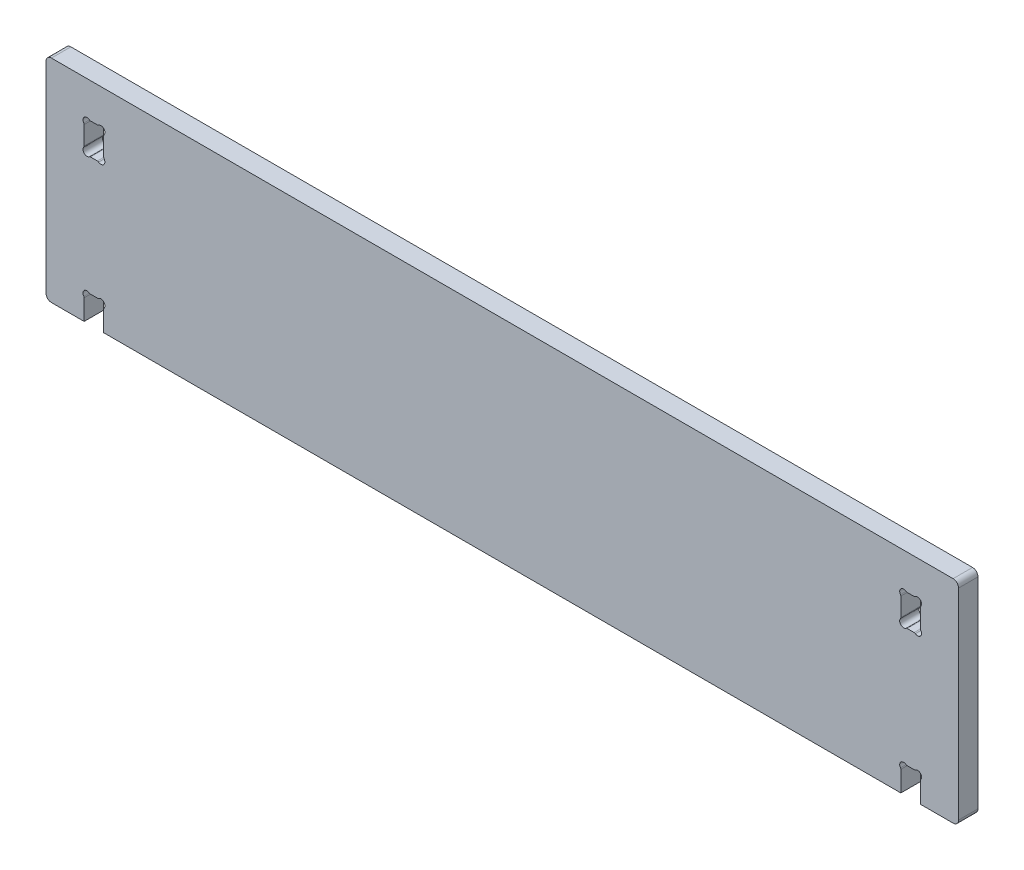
SolidWorks part; units mm, degrees
ref_plane "Front Plane" through (0, 0, 0) normal (0, 0, 1) x (1, 0, 0)
ref_plane "Top Plane" through (0, 0, 0) normal (0, 1, 0) x (1, 0, 0)
ref_plane "Right Plane" through (0, 0, 0) normal (1, 0, 0) x (0, 0, -1)
sketch "Sketch1" plane through (0, 0, 0) normal (0, 0, 1) x (1, 0, 0)
  line L0 (1174, 45) -> (0, 45) construction
  line L2 (587, -227.4167) -> (74.2667, -227.4167)
  line L3 (49.0667, 0) -> (74.2667, 0) construction
  line L4 (56, -193) -> (38, -193) construction
  line L5 (61.6667, -40.1) -> (61.6667, -227.4167) construction
  line L6 (0, -227.4167) -> (0, 45)
  line L7 (0, 45) -> (587, 45)
  line L8 (587, 45) -> (587, -227.4167)
  line L9 (61.6667, -20) -> (49.0667, -20) construction
  line L10 (74.2667, -201.031) -> (74.2667, -227.4167)
  line L11 (74.2667, -192.9) -> (61.6667, -205.5) construction
  line L12 (57.1977, -192.9) -> (66.1356, -192.9)
  line L13 (1174, -233.25) -> (0, -233.25) construction
  line L14 (49.0667, -201.031) -> (49.0667, -227.4167)
  line L15 (49.0667, -227.4167) -> (0, -227.4167)
  line L16 (66.1356, -40.1) -> (57.1977, -40.1)
  line L17 (74.2667, -8.031) -> (74.2667, -31.969)
  line L18 (61.6667, 0.1) -> (61.6667, -40.1) construction
  line L19 (66.1356, 0.1) -> (57.1977, 0.1)
  line L20 (49.0667, -8.031) -> (49.0667, -31.969)
  line L21 (49.0667, 0.1) -> (52.6729, -3.5062) construction
  line L24 (45, -40) -> (70, -40) construction
  arc A0 (74.2667, -201.031) -> (74.758, -199.5426) centre (76.7667, -201.031) cw
  arc A1 (74.758, -199.5426) -> (67.624, -192.4086) centre (70.6604, -196.5062) ccw
  arc A2 (66.1356, -192.9) -> (67.624, -192.4086) centre (66.1356, -190.4) ccw
  arc A3 (49.0667, -201.031) -> (48.5753, -199.5426) centre (46.5667, -201.031) ccw
  arc A4 (48.5753, -199.5426) -> (55.7093, -192.4086) centre (52.6729, -196.5062) cw
  arc A5 (57.1977, -192.9) -> (55.7093, -192.4086) centre (57.1977, -190.4) cw
  arc A6 (55.7093, 0.5914) -> (48.5753, -6.5426) centre (52.6729, -3.5062) ccw
  arc A7 (55.7093, 0.5914) -> (57.1977, 0.1) centre (57.1977, 2.6) ccw
  arc A8 (48.5753, -6.5426) -> (49.0667, -8.031) centre (46.5667, -8.031) cw
  arc A9 (48.5753, -33.4574) -> (49.0667, -31.969) centre (46.5667, -31.969) ccw
  arc A10 (55.7093, -40.5914) -> (48.5753, -33.4574) centre (52.6729, -36.4938) cw
  arc A11 (55.7093, -40.5914) -> (57.1977, -40.1) centre (57.1977, -42.6) cw
  arc A12 (67.624, -40.5914) -> (66.1356, -40.1) centre (66.1356, -42.6) ccw
  arc A13 (67.624, -40.5914) -> (74.758, -33.4574) centre (70.6604, -36.4938) ccw
  arc A14 (74.758, -33.4574) -> (74.2667, -31.969) centre (76.7667, -31.969) cw
  arc A15 (74.758, -6.5426) -> (74.2667, -8.031) centre (76.7667, -8.031) ccw
  arc A16 (67.624, 0.5914) -> (74.758, -6.5426) centre (70.6604, -3.5062) cw
  arc A17 (67.624, 0.5914) -> (66.1356, 0.1) centre (66.1356, 2.6) cw
  point P2 (587, 45)
  point P33 (61.6667, -192.9)
  point P52 (49.0667, -20)
extrude "Boss-Extrude1" add sketch "Sketch1" along normal blind 25 contours L8 L2 L10 A0 A1 A2 L12 A5 A4 A3 L14 L15 L6 L7
fillet "Fillet1" radius 7 2 edges at (0, 45, 12.5) (0, -227.4167, 12.5)
mirror "Symétrie1" about plane through (587, 45, 25) normal (-1, 0, 0)
equation "\"tool_diameter\"=10"
equation "\"hole_clearance\"=0.1"
equation "\"material_thickness\"=25"
equation "\"clearance\"=0.1"
equation "\"outer_slot\"=0.5"
equation "\"fillet\"=7"
equation "\"D1@Boss-Extrude1\"=\"material_thickness\""
equation "\"D4@Sketch1\"=\"tool_diameter\"/2+\"hole_clearance\""
equation "\"D3@Sketch1\"=\"material_thickness\"/2+\"clearance\""
equation "\"D5@Sketch1\"=\"material_thickness\"/10"
equation "\"string\"= 2 * \"tool_diameter\" / 2 * cos ( 45deg )"
equation "\"angle\"= IIF ( \"string\" < \"limit\" , 45 , ( 180 - 2 * arcsin ( \"ThicknessVStool_dia\" ) ) / 2 )"
equation "\"limit\"= \"material_thickness\" / 2 * 5 / 6"
equation "\"ThicknessVStool_dia\"= IIF ( \"limit\" / \"tool_diameter\" > 1 , 1 , \"limit\" / \"tool_diameter\" )"
equation "\"D2@Sketch1\"=\"angle\""
equation "\"D1@Fillet1\"=\"fillet\""
equation "\"D10@Sketch1\"=\"tool_diameter\" / 2 + \"hole_clearance\""
equation "\"D8@Sketch1\"=\"material_thickness\" / 2 + \"clearance\""
equation "\"D11@Sketch1\"=\"material_thickness\"/10"
equation "\"D7@Sketch1\"=\"angle\""
equation "\"D9@Sketch1\"= \"tool_diameter\" / 2 * 7 / 6"
equation "\"D12@Sketch1\"=\"clearance\""
equation "\"D13@Sketch1\"=\"clearance\""
equation "\"D14@Sketch1\"=20 + \"material_thickness\"*7/6 -\"clearance\""
equation "\"D15@Sketch1\"= 20 + \"clearance\""
equation "\"D17@Sketch1\"=\"clearance\""
